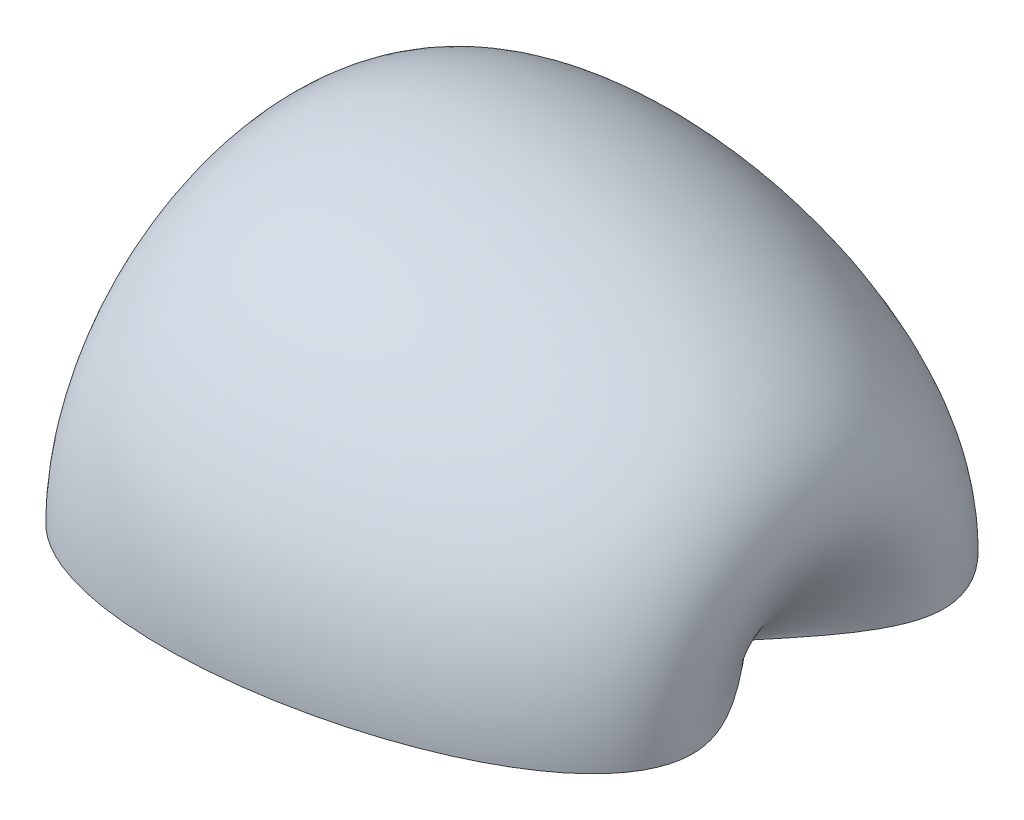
SolidWorks part; units mm, degrees
ref_plane "Front Plane" through (0, 0, 0) normal (0, 0, 1) x (1, 0, 0)
ref_plane "Top Plane" through (0, 0, 0) normal (0, 1, 0) x (1, 0, 0)
ref_plane "Right Plane" through (0, 0, 0) normal (1, 0, 0) x (0, 0, -1)
sketch "Sketch1" plane through (0, 0, 0) normal (0, 1, 0) x (1, 0, 0)
  line L1 (-130.6774, 97.9456) -> (120.2063, 97.9456)
  line L2 (-130.6774, 97.9456) -> (-130.6774, -125.004)
  line L3 (-130.6774, -125.004) -> (120.2063, -125.004)
  line L4 (120.2063, 97.9456) -> (120.2063, -125.004)
surface "Surface-Plane1" sketch "Sketch1"
sketch "Sketch2" plane through (0, 0, 0) normal (0, 0, 1) x (1, 0, 0)
  line L0 (-130.6774, 0) -> (120.2063, 0) construction
  line L1 (-55.0177, 0) -> (57.2715, 0) construction
  spline S0 degree 3 poles (-55.0177, 0) (-59.4178, 23.5719) (-73.3663, 98.2965) (104.863, 57.2348) (65.2723, 9.622) (57.2715, 0) knots 0 0 0 0 0.26884 0.852242 1 1 1 1
surface "Surface-Revolve1" sketch "Sketch2" parameters "D1"=180
surface "Surface-Trim1"
